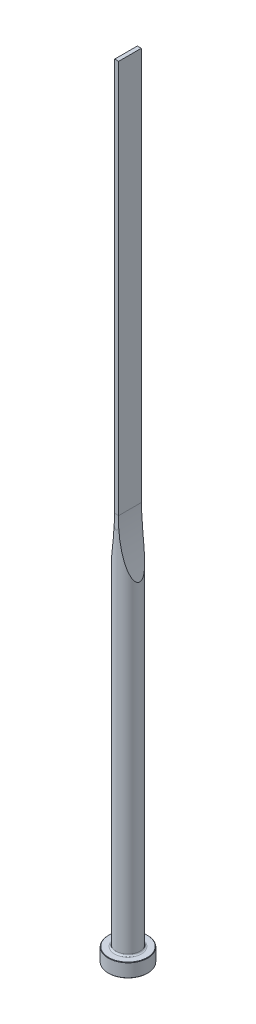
SolidWorks part; units mm, degrees
ref_plane "Front Plane" through (0, 0, 0) normal (0, 0, 1) x (1, 0, 0)
ref_plane "Top Plane" through (0, 0, 0) normal (0, 1, 0) x (1, 0, 0)
ref_plane "Right Plane" through (0, 0, 0) normal (1, 0, 0) x (0, 0, -1)
sketch "Sketch1" plane through (0, 0, 0) normal (0, 0, 1) x (1, 0, 0)
  line L0 (0, 0) -> (9.8, 0)
  line L1 (55, 0) -> (-55, 0) construction
  line L2 (10, 0.2) -> (10, 6.8)
  line L3 (9.8, 7) -> (6.8, 7)
  line L4 (6, 7.8) -> (6, 400)
  line L5 (0, 400) -> (6, 400)
  line L6 (10, 6.8) -> (9.8, 7)
  line L7 (9.8, 0) -> (10, 0.2)
  line L8 (0, 400) -> (0, 0)
  arc A0 (6, 7.8) -> (6.8, 7) centre (6.8, 7.8) ccw
  point P1 (10, 0)
  point P6 (10, 7)
  dimension "D4" = 0.8
  dimension "D1" = 6
  dimension "D2" = 10
  dimension "D3" = 7
  dimension "D5" = 400
revolve "Revolve1" add sketch "Sketch1" angle 360 about L8
sketch "Sketch2" plane through (0, 0, 0) normal (0, 0, 1) x (1, 0, 0)
  line L0 (1, 400) -> (1, 200)
  line L1 (6, 400) -> (-6, 400) construction
  line L2 (-1, 400) -> (-1, 200)
  line L3 (6, 400) -> (6, 170.4196)
  line L4 (-6, 400) -> (-6, 170.4196)
  line L5 (0, -55) -> (0, 55) construction
  line L6 (6, 400) -> (1, 400)
  line L8 (-1, 400) -> (-6, 400)
  arc A0 (1, 200) -> (6, 170.4196) centre (91, 200) ccw
  arc A1 (-1, 200) -> (-6, 170.4196) centre (-91, 200) cw
  dimension "D4" = 90
  dimension "D1" = 200
  dimension "D2" = 2
  dimension "D3" = 1
extrude "Cut-Extrude1" cut sketch "Sketch2" against normal mid plane 15
sketch "Sketch3" plane through (0, 0, 0) normal (1, 0, 0) x (0, 0, -1)
  line L0 (5.75, 400) -> (5.75, 200)
  line L1 (-5.9161, 400) -> (5.9161, 400) construction
  line L2 (-5.75, 400) -> (-5.75, 200)
  line L3 (6, 400) -> (6, 193.2965)
  line L4 (5.75, 400) -> (6, 400)
  line L5 (0, 11) -> (0, -11) construction
  line L6 (-6, 400) -> (-6, 193.2965)
  line L8 (-5.75, 400) -> (-6, 400)
  arc A0 (5.75, 200) -> (6, 193.2965) centre (95.75, 200) ccw
  arc A1 (-5.75, 200) -> (-6, 193.2965) centre (-95.75, 200) cw
  dimension "D2" = 90
  dimension "D1" = 200
  dimension "D3" = 11.5
  dimension "D4" = 5.75
extrude "Cut-Extrude2" cut sketch "Sketch3" against normal mid plane 15
